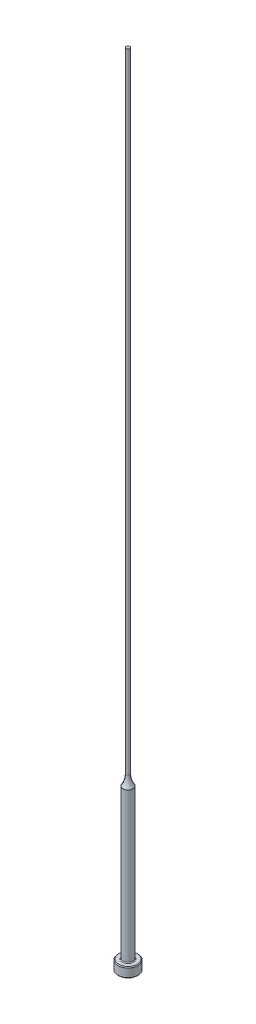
SolidWorks part; units mm, degrees
ref_plane "Front Plane" through (0, 0, 0) normal (0, 0, 1) x (1, 0, 0)
ref_plane "Top Plane" through (0, 0, 0) normal (0, 1, 0) x (1, 0, 0)
ref_plane "Right Plane" through (0, 0, 0) normal (1, 0, 0) x (0, 0, -1)
sketch "Sketch1" plane through (0, 0, 0) normal (0, 0, 1) x (1, 0, 0)
  line L0 (0, 259.9588) -> (0, -15.1925) construction
  line L1 (0, 0) -> (-3.175, 0)
  line L2 (-3.175, 0) -> (-3.175, 3.175)
  line L3 (-3.175, 3.175) -> (-1.5875, 3.175)
  line L4 (-0.5944, 54.2098) -> (-0.5944, 254)
  line L5 (-0.5944, 254) -> (0, 254)
  line L6 (0, 254) -> (0, 0)
  line L7 (-1.5875, 3.175) -> (-1.5875, 50.8)
  arc A0 (-1.5875, 50.8) -> (-0.5944, 54.2098) centre (-6.9444, 54.2098) ccw
  point P13 (-1.5875, 0)
  dimension "D1" = 6.35
  dimension "L" = 254
  dimension "D2" = 3.175
  dimension "H" = 6.35
  dimension "T" = 3.175
  dimension "D" = 1.1887
  dimension "S" = 50.8
revolve "Revolve1" add sketch "Sketch1" angle 360 about L0
chamfer "Chamfer1" distance 0.254 angle 45 2 edges at (0, 3.175, 3.175) (0, 0, 3.175)
fillet "Fillet1" radius 0.254 1 edges at (0, 3.175, 1.5875)
